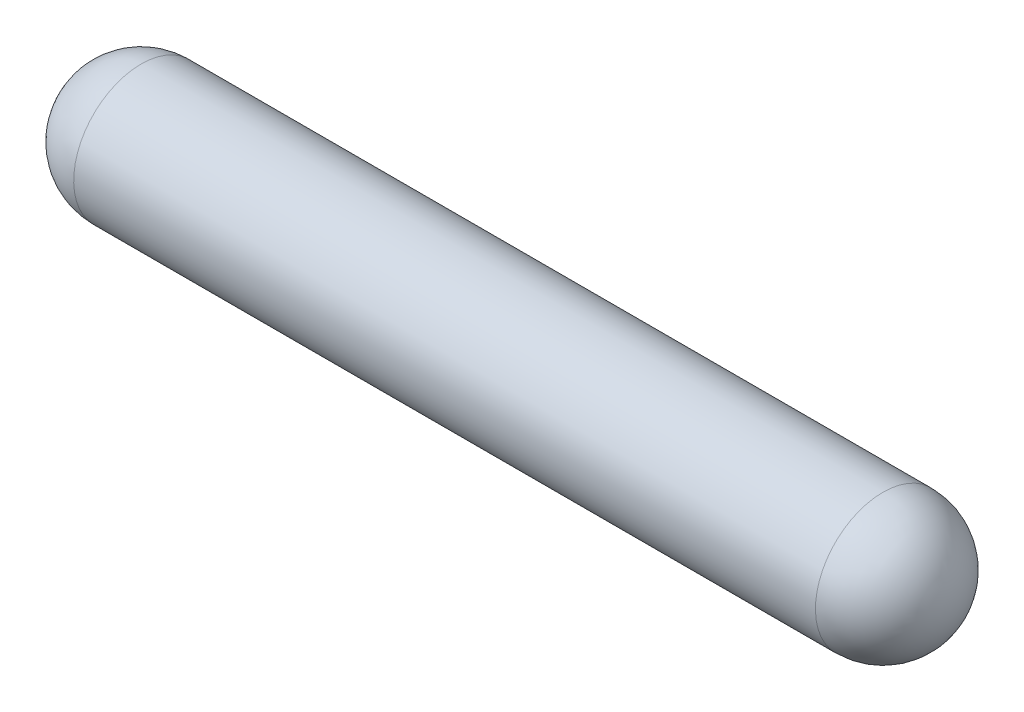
SolidWorks part; units mm, degrees
ref_plane "Plane1" through (0, 0, 0) normal (0, 0, 1) x (1, 0, 0)
ref_plane "Plane2" through (0, 0, 0) normal (0, 1, 0) x (1, 0, 0)
ref_plane "Plane3" through (0, 0, 0) normal (1, 0, 0) x (0, 0, -1)
sketch "Sketch1" plane through (0, 0, 0) normal (0, 0, 1) x (1, 0, 0)
  line L0 (0, 0) -> (-69.85, 0) construction
  line L1 (-34.925, 3.175) -> (0, 3.175)
  line L2 (-38.1, 0) -> (3.175, 0)
  arc A0 (3.175, 0) -> (0, 3.175) centre (0, 0) ccw
  arc A1 (-34.925, 3.175) -> (-38.1, 0) centre (-34.925, 0) ccw
  dimension "D4" = 6.35
  dimension "D5" = 6.35
  dimension "D1" = 41.275
revolve "Base-Revolve" add sketch "Sketch1" angle 360 about L0
